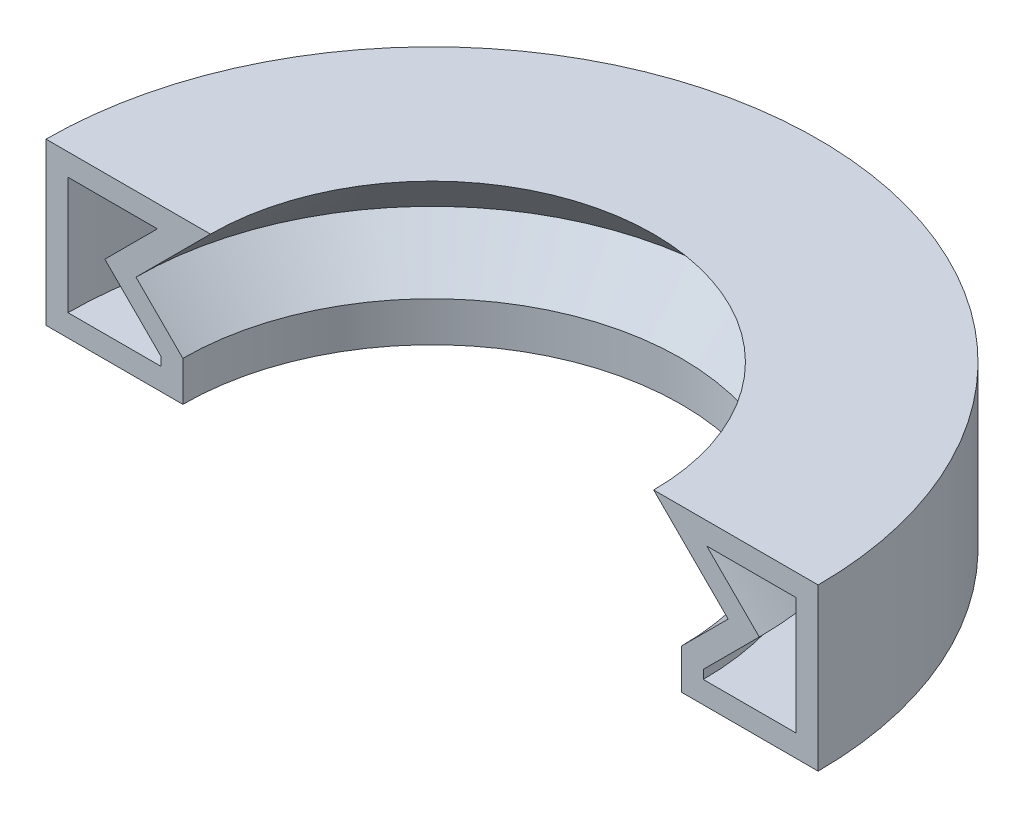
SolidWorks part; units mm, degrees
ref_plane "Front Plane" through (0, 0, 0) normal (0, 0, 1) x (1, 0, 0)
ref_plane "Top Plane" through (0, 0, 0) normal (0, 1, 0) x (1, 0, 0)
ref_plane "Right Plane" through (0, 0, 0) normal (1, 0, 0) x (0, 0, -1)
sketch "Sketch1" plane through (0, 0, 0) normal (0, 0, 1) x (1, 0, 0)
  line L0 (0, 0) -> (0, 108.4597) construction
  line L1 (150, 0) -> (150, 50)
  line L2 (150, 50) -> (110, 50)
  line L3 (110, 50) -> (132.5, 27.5)
  line L4 (132.5, 27.5) -> (110, 5)
  line L5 (110, 5) -> (110, 0)
  line L6 (110, 0) -> (150, 0)
  line L7 (132.5, 27.5) -> (89.9216, 27.5) construction
  dimension "D1" = 300
  dimension "D2" = 50
  dimension "D3" = 40
  dimension "D4" = 5
revolve "Revolve-Thin1" add sketch "Sketch1" angle 180 about L0
